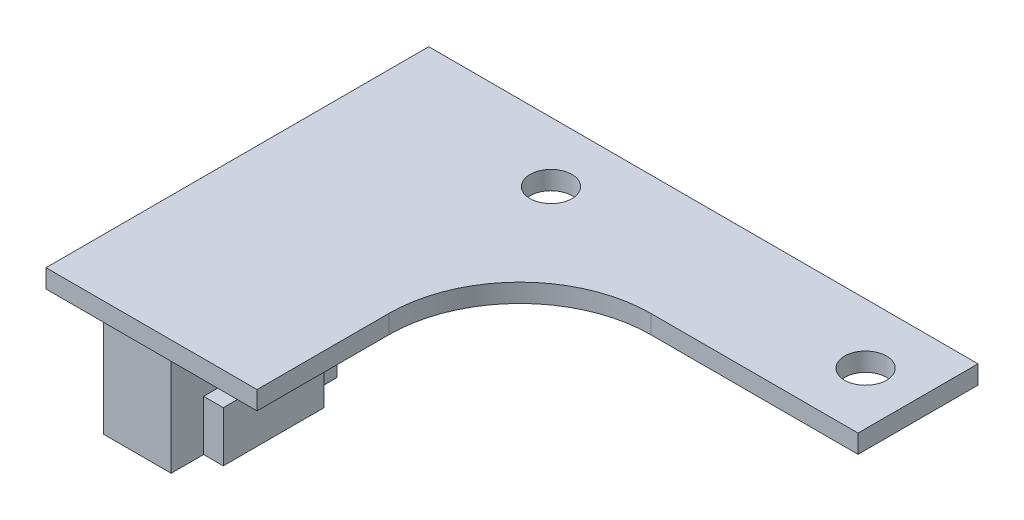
SolidWorks part; units mm, degrees
ref_plane "Front" through (0, 0, 0) normal (0, 0, 1) x (1, 0, 0)
ref_plane "Top" through (0, 0, 0) normal (0, 1, 0) x (1, 0, 0)
ref_plane "Right" through (0, 0, 0) normal (1, 0, 0) x (0, 0, -1)
sketch "Sketch1" plane through (0, 0, 0) normal (0, 1, 0) x (1, 0, 0)
  line L0 (28, 4.575) -> (28, -4.575)
  line L1 (28, 4.575) -> (-13.9, 4.575)
  line L2 (-13.9, 4.575) -> (-13.9, -24.625)
  line L3 (-13.9, -24.625) -> (2.2, -24.625)
  line L4 (28, -4.575) -> (12.2, -4.575)
  line L5 (2.2, -14.575) -> (2.2, -24.625)
  circle A0 centre (0, 0) radius 1.6
  circle A1 centre (24, 0) radius 1.6
  arc A2 (12.2, -4.575) -> (2.2, -14.575) centre (12.2, -14.575) ccw
  point P7 (28, 0)
extrude "Boss-Extrude1" add sketch "Sketch1" along normal blind 1.41
sketch "Sketch2" plane through (0, 0, 0) normal (0, -1, 0) x (1, 0, 0)
  line L0 (-13.9, -4.575) -> (-13.9, 24.625) construction
  line L1 (-13.9, 20.225) -> (-8.75, 20.225)
  line L2 (-13.9, 20.225) -> (-13.9, 7.575)
  line L3 (-13.9, 7.575) -> (-8.75, 7.575)
  line L4 (-8.75, 20.225) -> (-8.75, 7.575)
  line L5 (-13.9, 20.225) -> (-8.75, 7.575) construction
  line L6 (-13.9, 7.575) -> (-8.75, 20.225) construction
  line L7 (-13.9, 24.625) -> (2.2, 24.625) construction
  point P0 (-11.325, 13.9)
  dimension "D1" = 5.15
  dimension "D2" = 12.65
  dimension "D3" = 4.4
extrude "Boss-Extrude2" add sketch "Sketch2" along normal blind 11.8
sketch "Sketch3" plane through (-8.75, 0, 0) normal (1, 0, 0) x (0, 0, -1)
  line L0 (-7.575, -11.8) -> (-20.225, -11.8) construction
  line L1 (-17.75, -11.8) -> (-10.05, -11.8)
  line L2 (-17.75, -11.8) -> (-17.75, -7.95)
  line L3 (-17.75, -7.95) -> (-10.05, -7.95)
  line L4 (-10.05, -11.8) -> (-10.05, -7.95)
  line L5 (-17.75, -11.8) -> (-10.05, -7.95) construction
  line L6 (-17.75, -7.95) -> (-10.05, -11.8) construction
  point P0 (-13.9, -9.875)
  point P8 (-13.9, -11.8)
  dimension "D1" = 3.85
  dimension "D2" = 7.7
extrude "Boss-Extrude3" add sketch "Sketch3" along normal blind 1.5
equation "\"D2@Sketch1\"=\"D1@Sketch1\""
